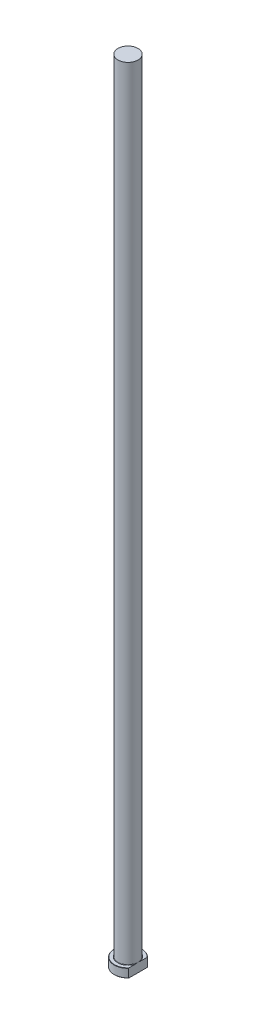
SolidWorks part; units mm, degrees
ref_plane "Front Plane" through (0, 0, 0) normal (0, 0, 1) x (1, 0, 0)
ref_plane "Top Plane" through (0, 0, 0) normal (0, 1, 0) x (1, 0, 0)
ref_plane "Right Plane" through (0, 0, 0) normal (1, 0, 0) x (0, 0, -1)
sketch "Sketch1" plane through (0, 0, 0) normal (0, 0, 1) x (1, 0, 0)
  line L0 (0, 259.9588) -> (0, -15.1925) construction
  line L1 (0, 0) -> (-11, 0)
  line L2 (-11, 0) -> (-11, 7)
  line L3 (-11, 7) -> (-8, 7)
  line L4 (-8, 7) -> (-8, 630)
  line L5 (-8, 630) -> (0, 630)
  line L6 (0, 630) -> (0, 0)
  dimension "L" = 630
  dimension "H" = 22
  dimension "T" = 7
  dimension "D" = 16
revolve "Revolve1" add sketch "Sketch1" angle 360 about L0
chamfer "Chamfer1" distance 0.2 angle 45 2 edges at (0, 7, 11) (0, 0, 11)
fillet "Fillet1" radius 0.3 1 edges at (0, 7, 8)
sketch "Sketch2" plane through (0, 0, 0) normal (0, 1, 0) x (1, 0, 0)
  line L0 (8, 7.5498) -> (8, -7.5498)
  circle A0 centre (0, 0) radius 11 construction
  arc A1 (8, -7.5498) -> (8, 7.5498) centre (0, 0) ccw
  circle A2 centre (0, 0) radius 8 construction
extrude "KEY" cut sketch "Sketch2" along normal through all
